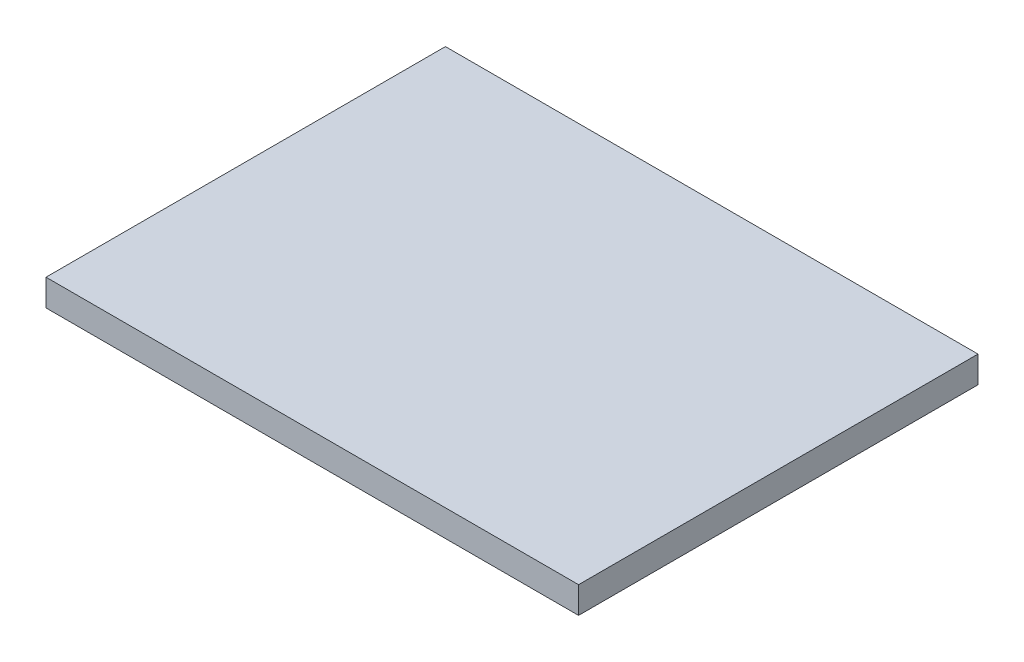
SolidWorks part; units mm, degrees
ref_plane "Front Plane" through (0, 0, 0) normal (0, 0, 1) x (1, 0, 0)
ref_plane "Top Plane" through (0, 0, 0) normal (0, 1, 0) x (1, 0, 0)
ref_plane "Right Plane" through (0, 0, 0) normal (1, 0, 0) x (0, 0, -1)
sketch "Sketch1" plane through (0, 0, 0) normal (0, 1, 0) x (1, 0, 0)
  line L1 (-50, 37.5) -> (50, 37.5)
  line L2 (-50, 37.5) -> (-50, -37.5)
  line L3 (-50, -37.5) -> (50, -37.5)
  line L4 (50, 37.5) -> (50, -37.5)
  line L5 (-50, 37.5) -> (50, -37.5) construction
  line L6 (-50, -37.5) -> (50, 37.5) construction
  point P0 (0, 0)
  dimension "D1" = 75
  dimension "D2" = 100
extrude "Boss-Extrude1" add sketch "Sketch1" along normal blind 5
